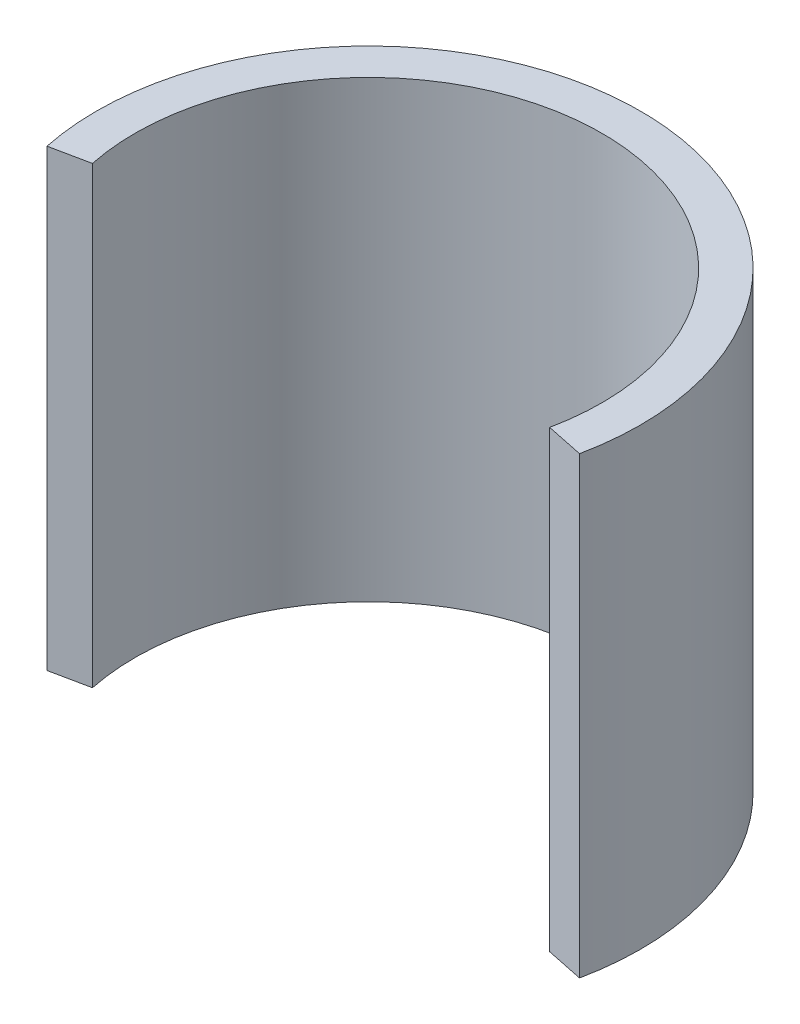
SolidWorks part; units mm, degrees
ref_plane "Front Plane" through (0, 0, 0) normal (0, 0, 1) x (1, 0, 0)
ref_plane "Top Plane" through (0, 0, 0) normal (0, 1, 0) x (1, 0, 0)
ref_plane "Right Plane" through (0, 0, 0) normal (1, 0, 0) x (0, 0, -1)
sketch "Sketch1" plane through (0, 0, 0) normal (0, 1, 0) x (1, 0, 0)
  arc A0 (0, 0) -> (69.1972, 0) centre (34.5986, 7.1764) cw
extrude "Extrude-Thin1" add sketch "Sketch1" along normal blind 59 thin
